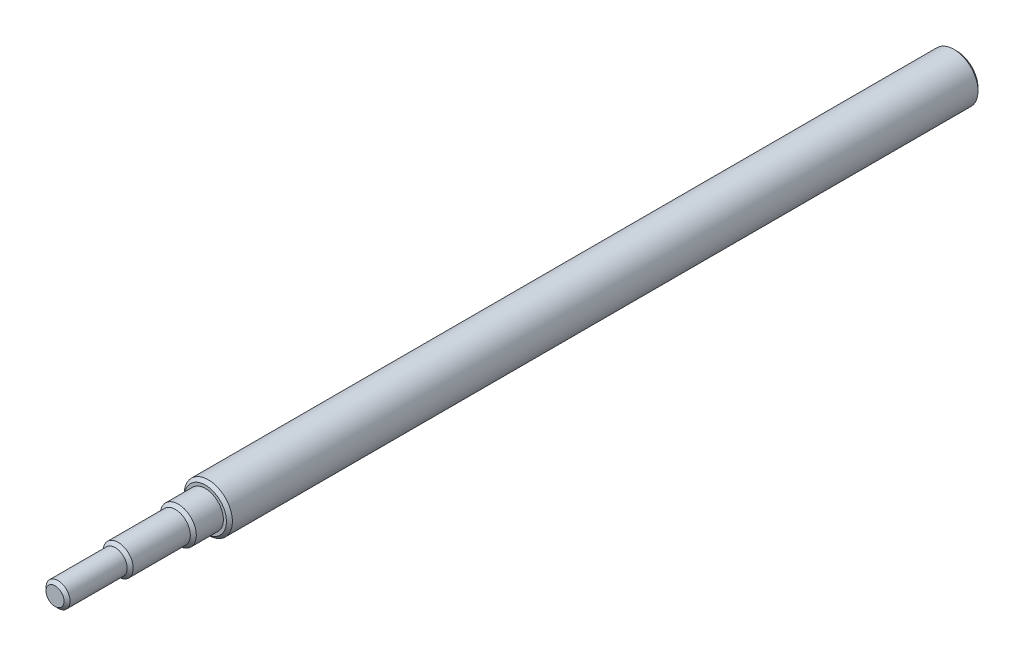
SolidWorks part; units mm, degrees
ref_plane "前视基准面" through (0, 0, 0) normal (0, 0, 1) x (1, 0, 0)
ref_plane "上视基准面" through (0, 0, 0) normal (0, 1, 0) x (1, 0, 0)
ref_plane "右视基准面" through (0, 0, 0) normal (1, 0, 0) x (0, 0, -1)
sketch "草图1" plane through (0, 0, 0) normal (0, 0, 1) x (1, 0, 0)
  circle A0 centre (0, 0) radius 8
extrude "凸台-拉伸1" add sketch "草图1" along normal blind 250
sketch "草图2" plane through (0, 0, 250) normal (0, 0, 1) x (1, 0, 0)
  circle A0 centre (0, 0) radius 6
extrude "凸台-拉伸2" add sketch "草图2" along normal blind 10
sketch "草图3" plane through (0, 0, 260) normal (0, 0, 1) x (1, 0, 0)
  circle A0 centre (0, 0) radius 5
extrude "凸台-拉伸3" add sketch "草图3" along normal blind 20
sketch "草图4" plane through (0, 0, 280) normal (0, 0, 1) x (1, 0, 0)
  circle A0 centre (0, 0) radius 4
extrude "凸台-拉伸4" add sketch "草图4" along normal blind 20
chamfer "倒角1" distance 1 angle 45 1 edges at (8, 0, 0)
chamfer "倒角2" distance 1 angle 45 1 edges at (8, 0, 250)
chamfer "倒角3" distance 1 angle 45 3 edges at (4, 0, 300) (5, 0, 280) (6, 0, 260)
